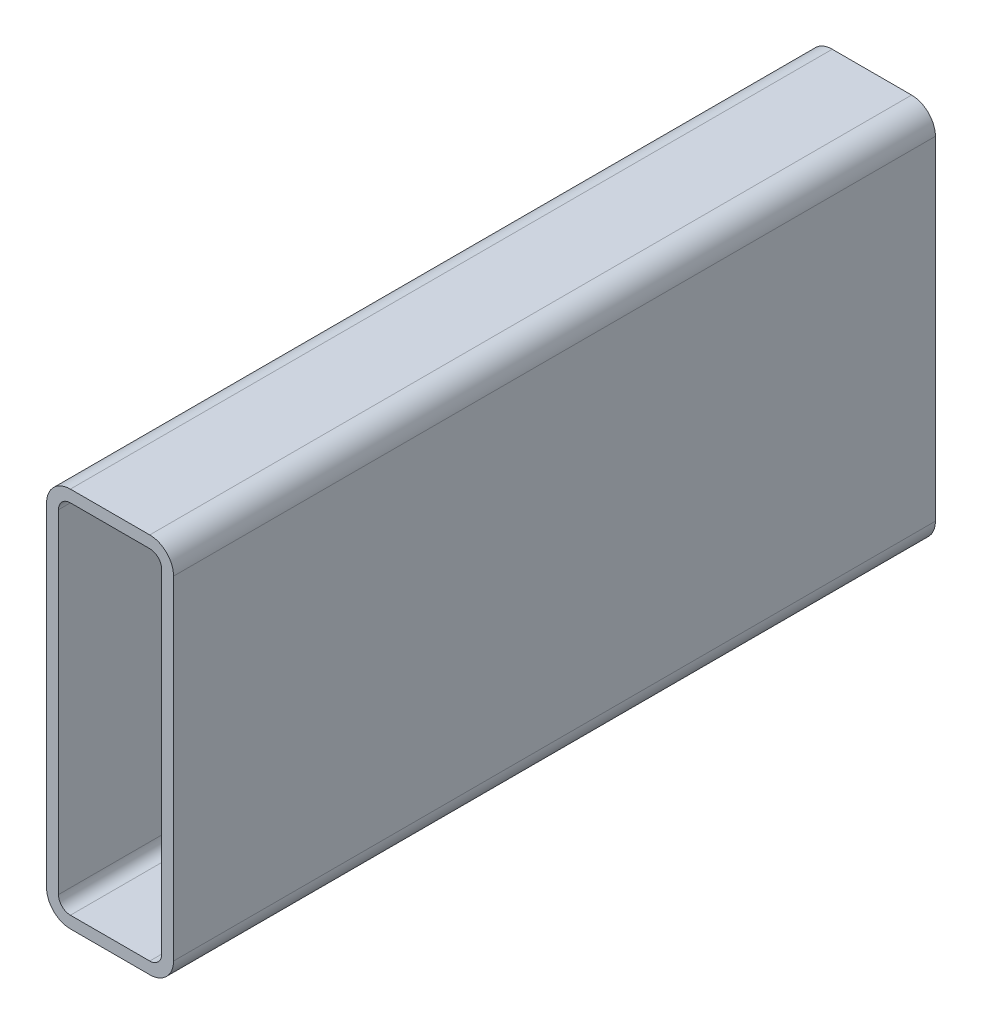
SolidWorks part; units mm, degrees
ref_plane "Front Plane" through (0, 0, 0) normal (0, 0, 1) x (1, 0, 0)
ref_plane "Top Plane" through (0, 0, 0) normal (0, 1, 0) x (1, 0, 0)
ref_plane "Right Plane" through (0, 0, 0) normal (1, 0, 0) x (0, 0, -1)
sketch "Sketch1" plane through (0, 0, 0) normal (0, 0, 1) x (1, 0, 0)
  line B0 (9.525, 152.4) -> (41.275, 152.4)
  arc B1 (50.8, 142.875) -> (41.275, 152.4) centre (41.275, 142.875) ccw
  line B2 (50.8, 142.875) -> (50.8, 9.525)
  arc B3 (41.275, 0) -> (50.8, 9.525) centre (41.275, 9.525) ccw
  line B4 (41.275, 0) -> (9.525, 0)
  arc B5 (0, 9.525) -> (9.525, 0) centre (9.525, 9.525) ccw
  line B6 (0, 9.525) -> (0, 142.875)
  arc B7 (9.525, 152.4) -> (0, 142.875) centre (9.525, 142.875) ccw
  line B8 (9.525, 147.6375) -> (41.275, 147.6375)
  arc B9 (46.0375, 142.875) -> (41.275, 147.6375) centre (41.275, 142.875) ccw
  line B10 (46.0375, 142.875) -> (46.0375, 9.525)
  arc B11 (41.275, 4.7625) -> (46.0375, 9.525) centre (41.275, 9.525) ccw
  line B12 (41.275, 4.7625) -> (9.525, 4.7625)
  arc B13 (4.7625, 9.525) -> (9.525, 4.7625) centre (9.525, 9.525) ccw
  line B14 (4.7625, 9.525) -> (4.7625, 142.875)
  arc B15 (9.525, 147.6375) -> (4.7625, 142.875) centre (9.525, 142.875) ccw
sketch_block_instance "HSS6x2x0.1875-1"
sketch_block "HSS6x2x0.1875"
extrude "Boss-Extrude1" add sketch "Sketch1" along normal blind 304.8
